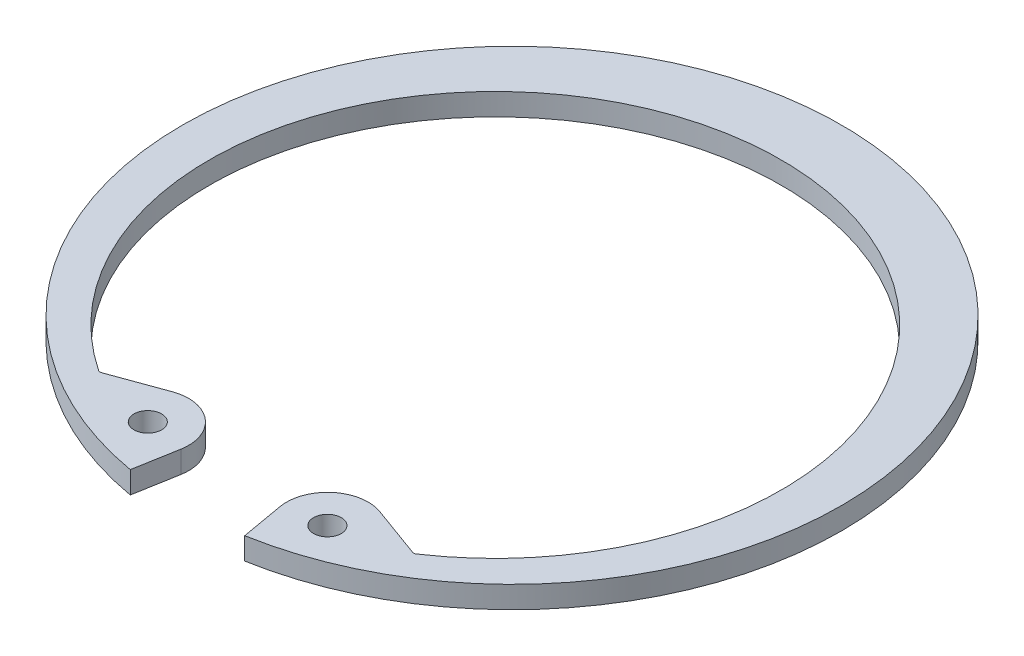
SolidWorks part; units mm, degrees
ref_plane "Front" through (0, 0, 0) normal (0, 0, 1) x (1, 0, 0)
ref_plane "Top" through (0, 0, 0) normal (0, 1, 0) x (1, 0, 0)
ref_plane "Right" through (0, 0, 0) normal (1, 0, 0) x (0, 0, -1)
sketch "Sketch2" plane through (0, 0, 0) normal (0, 1, 0) x (1, 0, 0)
  line L0 (0, 0) -> (0, -23.5966) construction
  line L1 (-11.2628, -18.3003) -> (-12.3678, -20.0957) construction
  line L2 (4.0975, -23.2381) -> (3.5543, -20.1573)
  line L3 (-4.0975, -23.2381) -> (-3.5543, -20.1573)
  line L4 (0, 19.2786) -> (0, 23.5966) construction
  line L5 (11.2628, -18.3003) -> (7.4299, -16.9052)
  line L6 (-11.2628, -18.3003) -> (-7.4299, -16.9052)
  line L7 (5.5224, -16.8739) -> (-6.2068, -20.7125) construction
  line L8 (-6.2068, -20.7125) -> (-4.3897, -26.2648) construction
  line L9 (-4.3897, -26.2648) -> (7.3394, -22.4262) construction
  line L10 (5.5224, -16.8739) -> (7.3394, -22.4262) construction
  line L11 (6.4309, -19.65) -> (3.5543, -20.1573) construction
  line L12 (6.4309, -19.65) -> (7.3394, -22.4262) construction
  line L13 (5.5224, -16.8739) -> (-5.5224, -16.8739) construction
  line L14 (-5.5224, -16.8739) -> (-7.3394, -22.4262) construction
  line L15 (-23.5966, 0) -> (23.5966, 0) construction
  arc A1 (4.0975, -23.2381) -> (-4.0975, -23.2381) centre (0, 0) ccw
  arc A2 (11.2628, -18.3003) -> (-11.2628, -18.3003) centre (0, -1.1986) ccw
  circle A3 centre (0, 0) radius 23.5966 construction
  arc A4 (3.5543, -20.1573) -> (7.4299, -16.9052) centre (6.4309, -19.65) cw
  arc A5 (-3.5543, -20.1573) -> (-7.4299, -16.9052) centre (-6.4309, -19.65) ccw
  circle A6 centre (6.4309, -19.65) radius 0.9906
  circle A7 centre (-6.4309, -19.65) radius 0.9906
  arc A8 (11.2628, -18.3003) -> (-11.2628, -18.3003) centre (0, -1.1986) cw construction
  circle A9 centre (0, 0) radius 17.272 construction
  point P5 (6.4309, -19.65)
  point P10 (5.5224, -16.8739)
  dimension "D1" = 60
  dimension "D2" = 60
  dimension "L" = 34.544
  dimension "R" = 1.9812
  dimension "Df" = 47.1932
  dimension "H" = 5.842
  dimension "Angle" = 10
  dimension "Sec. Max" = 4.318
  dimension "Sec. Min" = 2.1082
extrude "Extrude1" add sketch "Sketch2" against normal blind 1.5748
fillet "Fillet1" radius 0.254 2 edges at (-11.2628, -0.7874, 18.3003) (11.2628, -0.7874, 18.3003)
sketch "Sketch3" plane through (0, 0, 0) normal (1, 0, 0) x (0, 0, -1)
  line L0 (-22.225, -16.4592) -> (-22.225, -1.651)
  line L1 (-22.225, -1.651) -> (-23.5966, -1.651)
  line L2 (-23.5966, -1.651) -> (-23.5966, 0.0762)
  line L3 (-23.5966, 0.0762) -> (-22.225, 0.0762)
  line L4 (-22.225, 0.0762) -> (-22.225, 2.4384)
  line L5 (-22.225, -16.4592) -> (-24.9682, -16.4592)
  line L6 (-22.225, -1.651) -> (0, -1.651) construction
  line L7 (-22.225, 2.4384) -> (-24.9682, 2.4384)
  line L8 (0, 130.3401) -> (0, 164.6301) construction
  line L9 (0, -1.651) -> (0, 0.0762) construction
  line L10 (0, 0.0762) -> (-22.225, 0.0762) construction
  line L11 (-23.5966, -0.7874) -> (0, -0.7874) construction
  line L12 (0, -135.0899) -> (0, 130.3401) construction
  line L13 (-18.229, -1.5748) -> (19.2786, -1.5748) construction
  line L14 (-24.9682, -16.4592) -> (-24.9682, 2.4384)
  dimension "D1" = 0.7874
  dimension "Shaft Lg" = 18.8976
  dimension "Dg" = 47.1932
  dimension "Db" = 44.45
  dimension "W" = 1.7272
  dimension "D2" = 1.3716
  dimension "D3" = 2.3622
  dimension "D4" = 1.3716
revolve "Revolve1" [suppressed] add sketch "Sketch3" angle 360 about L8
delete or keep bodies "Body-Delete1" [suppressed] type delete bodies bodies 116
equation "\"D3@Sketch3\" = \"Shaft Lg@Sketch3\"/8"
equation "\"Shaft Lg@Sketch3\" = \"D1@Extrude1\"*12"
equation "\"D1@Sketch3\" = \"D1@Extrude1\"/2"
equation "\"D2@Sketch3\" = \"D4@Sketch3\""
